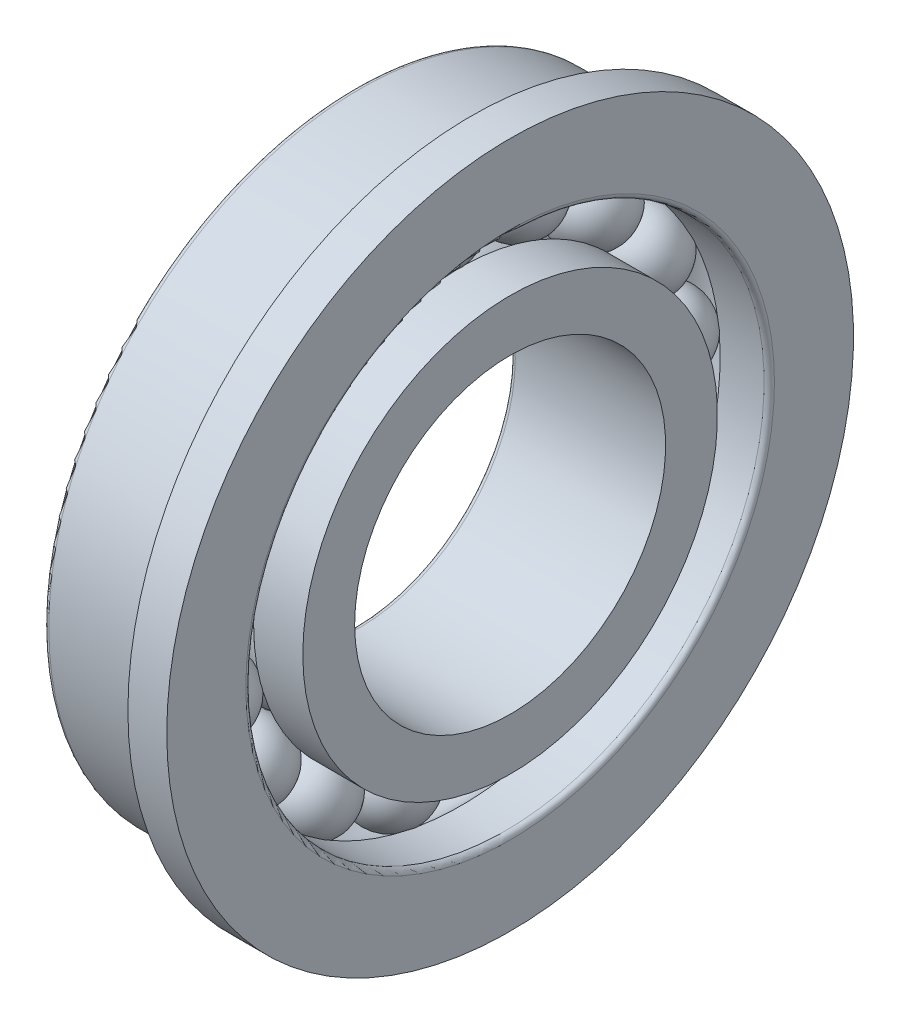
SolidWorks part; units mm, degrees
ref_plane "Front" through (0, 0, 0) normal (0, 0, 1) x (1, 0, 0)
ref_plane "Top" through (0, 0, 0) normal (0, 1, 0) x (1, 0, 0)
ref_plane "Right" through (0, 0, 0) normal (1, 0, 0) x (0, 0, -1)
sketch "Sketch1" plane through (0, 0, 0) normal (0, 0, 1) x (1, 0, 0)
  line L0 (-0.8071, 0) -> (0.9386, 0) construction
  line L1 (-0.8071, 9) -> (0.9386, 9) construction
  line L2 (-1.5, 9) -> (1.5, 9)
  arc A0 (-1.5, 9) -> (1.5, 9) centre (0, 9) ccw
revolve "Revolve1" add sketch "Sketch1" angle 360 about L1
sketch "Sketch2" plane through (0, 0, 0) normal (0, 0, 1) x (1, 0, 0)
  line L0 (-3, 8) -> (-1.1046, 8)
  line L1 (3, 8) -> (3, 6)
  line L2 (3, 6) -> (-3, 6)
  line L3 (-3, 6) -> (-3, 8)
  line L4 (-0.8417, 0) -> (1.1297, 0) construction
  line L5 (-0.8417, 9) -> (0.9121, 9) construction
  line L6 (1.1046, 8) -> (3, 8)
  arc A0 (-1.1046, 8) -> (1.1046, 8) centre (0, 9) ccw
revolve "Revolve2" add sketch "Sketch2" angle 360 about L4
sketch "Sketch3" plane through (0, 0, 0) normal (0, 0, 1) x (1, 0, 0)
  line L0 (-3, 12) -> (-3, 10)
  line L1 (-3, 10) -> (-1.1046, 10)
  line L2 (3, 10) -> (3, 13.25)
  line L3 (3, 13.25) -> (1.5, 13.25)
  line L4 (1.5, 13.25) -> (1.5, 12.0625)
  line L5 (1.4375, 12) -> (-3, 12)
  line L6 (-0.9997, 0) -> (1.1297, 0) construction
  line L8 (-0.9997, 9) -> (0.9355, 9) construction
  line L9 (1.1046, 10) -> (3, 10)
  arc A0 (1.1046, 10) -> (-1.1046, 10) centre (0, 9) ccw
  arc A1 (1.4375, 12) -> (1.5, 12.0625) centre (1.5, 12) ccw
revolve "Revolve3" add sketch "Sketch3" angle 360 about L6
pattern_circular "Circular-Pattern1" count 17 over 360 about axis through (0, 0, 0) along (1, 0, 0) of "Revolve1"
fillet "Fillet1" radius 0.2 3 edges at (3, 0, 10) (-3, 0, 12) (-3, 0, 6)
equation "\"D1@Sketch1\" = ( \"DD@Sketch3\" + \"D1@Sketch2\" )  / 4"
equation "\"D2@Sketch1\" =  ( \"DD@Sketch3\" - \"D1@Sketch2\" )  / 4"
equation "\"D4@Sketch2\" = \"D3@Sketch2\" / 2"
equation "\"D5@Sketch2\" = \"D1@Sketch2\" +  ( \"DD@Sketch3\" - \"D1@Sketch2\" )  / 3"
equation "\"D2@Sketch2\" = ( \"DD@Sketch3\" + \"D1@Sketch2\" )  / 4"
equation "\"D6@Sketch2\" =  ( \"DD@Sketch3\" - \"D1@Sketch2\" )  / 4 - 0.02"
equation "\"B@Sketch3\" = \"D3@Sketch2\""
equation "\"D6@Sketch3\" = \"B@Sketch3\" / 2"
equation "\"R@Sketch3\" = ( \"DD@Sketch3\" + \"D1@Sketch2\" )  / 4"
equation "\"D7@Sketch3\" = \"DD@Sketch3\" -  ( \"DD@Sketch3\"  - \"D1@Sketch2\") / 3 "
equation "\"D8@Sketch3\" = ( \"DD@Sketch3\" - \"D1@Sketch2\" )  / 4 - 0.02"
equation "\"m@Circular-Pattern1\" = int( 3.14159265 / atn((\"D2@Sketch1\"/2) / sqr(( \"DD@Sketch3\" + \"D1@Sketch2\" )  / 4 * ( \"DD@Sketch3\" + \"D1@Sketch2\" )  / 4 - (\"D2@Sketch1\"/2) *  (\"D2@Sketch1\"/2))))-1"
equation "\"D1@Sketch3\" =  ( \"DD1@Sketch3\" - \"DD@Sketch3\" )  / 20"
